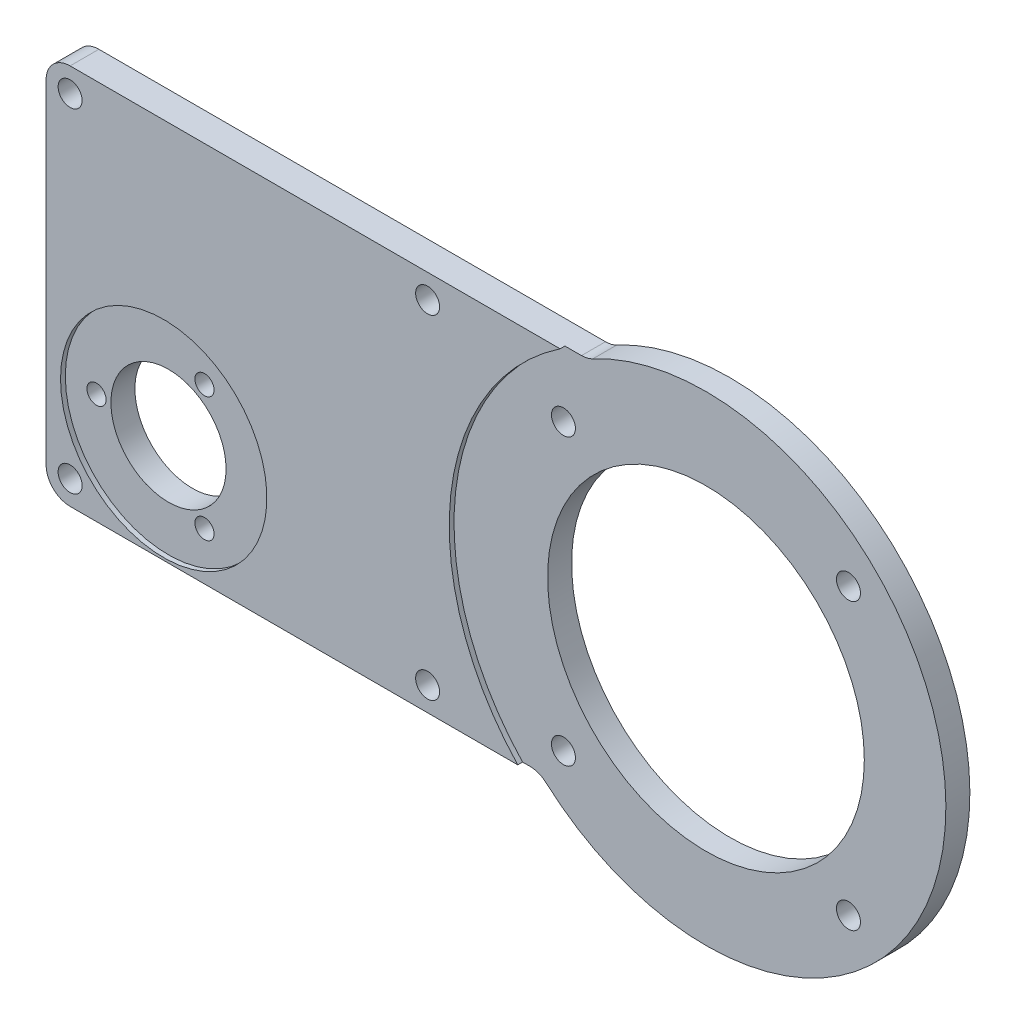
SolidWorks part; units mm, degrees
ref_plane "Plan de face" through (0, 0, 0) normal (0, 0, 1) x (1, 0, 0)
ref_plane "Plan de dessus" through (0, 0, 0) normal (0, 1, 0) x (1, 0, 0)
ref_plane "Plan de droite" through (0, 0, 0) normal (1, 0, 0) x (0, 0, -1)
ref_plane "Plan4" through (0, 0, 0) normal (0, 0, -1) x (-1, 0, 0)
sketch "Esquisse1" plane through (0, 0, 0) normal (0, 0, -1) x (-1, 0, 0)
  line L0 (73.3212, -72) -> (263, -72)
  line L1 (273, -62) -> (273, 77)
  line L2 (263, 87) -> (51.8748, 87)
  arc A0 (47.159, 88.1818) -> (66.6556, -74.5455) centre (0, 0) ccw
  arc A1 (66.6556, -74.5455) -> (73.3212, -72) centre (73.3212, -82) cw
  arc A2 (263, -72) -> (273, -62) centre (263, -62) ccw
  arc A3 (273, 77) -> (263, 87) centre (263, 77) ccw
  arc A4 (51.8748, 87) -> (47.159, 88.1818) centre (51.8748, 97) cw
extrude "Extrusion1" add sketch "Esquisse1" against normal blind 12
sketch "Esquisse2" plane through (0, 0, 12) normal (0, 0, 1) x (1, 0, 0)
  line L0 (-51.8748, 87) -> (-58.7878, 87)
  line L1 (-76.4264, -72) -> (-73.3212, -72)
  arc A0 (-47.159, 88.1818) -> (-51.8748, 87) centre (-51.8748, 97) cw
  arc A1 (-58.7878, 87) -> (-76.4264, -72) centre (0, 0) ccw
  arc A2 (-73.3212, -72) -> (-66.6556, -74.5455) centre (-73.3212, -82) cw
  arc A3 (-66.6556, -74.5455) -> (-47.159, 88.1818) centre (0, 0) ccw
extrude "Enlèv. mat.-Extru.1" cut sketch "Esquisse2" against normal blind 2
sketch "Esquisse3" plane through (0, 0, 12) normal (0, 0, 1) x (1, 0, 0)
  circle A0 centre (-224, -28) radius 43
extrude "Enlèv. mat.-Extru.2" cut sketch "Esquisse3" against normal blind 2
hole_wizard "Diamètre du perçage M10.0 (10)1" positions "Esquisse5" profile "Esquisse4" hole size "M10.0" standard "Ansi Métrique"
sketch "Esquisse5" plane through (0, 0, 10) normal (0, 0, 1) x (1, 0, 0)
  point P0 (59.397, -59.397)
sketch "Esquisse4" plane through (59.397, -59.397, 10) normal (1, 0, 0) x (0, -1, 0)
  line L0 (0, 0) -> (0, 10)
  line L1 (0, 10) -> (5, 10)
  line L2 (5, 10) -> (5, 0)
  line L5 (5, 0) -> (0, 0)
  line L11 (0, -6.35) -> (0, 107.95) construction
  dimension "Diamètre du perçage jusqu'au prochain" = 10
  dimension "Profondeur du perçage jusqu'au prochain" = 10
hole_wizard "Diamètre du perçage M10.0 (10)2" positions "Esquisse7" profile "Esquisse6" hole size "M10.0" standard "Ansi Métrique"
sketch "Esquisse7" plane through (0, 0, 10) normal (0, 0, 1) x (1, 0, 0)
  point P0 (59.397, 59.397)
sketch "Esquisse6" plane through (59.397, 59.397, 10) normal (1, 0, 0) x (0, -1, 0)
  line L0 (0, 0) -> (0, 10)
  line L1 (0, 10) -> (5, 10)
  line L2 (5, 10) -> (5, 0)
  line L5 (5, 0) -> (0, 0)
  line L11 (0, -6.35) -> (0, 107.95) construction
  dimension "Diamètre du perçage jusqu'au prochain" = 10
  dimension "Profondeur du perçage jusqu'au prochain" = 10
hole_wizard "Diamètre du perçage M10.0 (10)3" positions "Esquisse9" profile "Esquisse8" hole size "M10.0" standard "Ansi Métrique"
sketch "Esquisse9" plane through (0, 0, 12) normal (0, 0, 1) x (1, 0, 0)
  point P0 (-114, 77)
sketch "Esquisse8" plane through (-114, 77, 12) normal (1, 0, 0) x (0, -1, 0)
  line L0 (0, 0) -> (0, 12)
  line L1 (0, 12) -> (5, 12)
  line L2 (5, 12) -> (5, 0)
  line L5 (5, 0) -> (0, 0)
  line L11 (0, -6.35) -> (0, 107.95) construction
  dimension "Diamètre du perçage jusqu'au prochain" = 10
  dimension "Profondeur du perçage jusqu'au prochain" = 12
hole_wizard "Diamètre du perçage M10.0 (10)4" positions "Esquisse11" profile "Esquisse10" hole size "M10.0" standard "Ansi Métrique"
sketch "Esquisse11" plane through (0, 0, 10) normal (0, 0, 1) x (1, 0, 0)
  point P0 (-59.397, 59.397)
sketch "Esquisse10" plane through (-59.397, 59.397, 10) normal (1, 0, 0) x (0, -1, 0)
  line L0 (0, 0) -> (0, 10)
  line L1 (0, 10) -> (5, 10)
  line L2 (5, 10) -> (5, 0)
  line L5 (5, 0) -> (0, 0)
  line L11 (0, -6.35) -> (0, 107.95) construction
  dimension "Diamètre du perçage jusqu'au prochain" = 10
  dimension "Profondeur du perçage jusqu'au prochain" = 10
hole_wizard "Perçage1" positions "Esquisse13" profile "Esquisse12" legacy
sketch "Esquisse13" plane through (0, 0, 10) normal (0, 0, 1) x (1, 0, 0)
  point P0 (0, 0)
sketch "Esquisse12" plane through (0, 0, 10) normal (1, 0, 0) x (0, -1, 0)
  line L0 (0, 0) -> (0, 10)
  line L1 (0, 10) -> (66, 10)
  line L2 (66, 10) -> (66, 0)
  line L3 (66, 0) -> (0, 0)
  line L4 (0, 110) -> (0, -10) construction
  dimension "Diamètre" = 132
  dimension "Profondeur" = 10
hole_wizard "Diamètre du perçage M10.0 (10)5" positions "Esquisse15" profile "Esquisse14" hole size "M10.0" standard "Ansi Métrique"
sketch "Esquisse15" plane through (0, 0, 10) normal (0, 0, 1) x (1, 0, 0)
  point P0 (-59.397, -59.397)
sketch "Esquisse14" plane through (-59.397, -59.397, 10) normal (1, 0, 0) x (0, -1, 0)
  line L0 (0, 0) -> (0, 10)
  line L1 (0, 10) -> (5, 10)
  line L2 (5, 10) -> (5, 0)
  line L5 (5, 0) -> (0, 0)
  line L11 (0, -6.35) -> (0, 107.95) construction
  dimension "Diamètre du perçage jusqu'au prochain" = 10
  dimension "Profondeur du perçage jusqu'au prochain" = 10
hole_wizard "Diamètre du perçage M10.0 (10)6" positions "Esquisse17" profile "Esquisse16" hole size "M10.0" standard "Ansi Métrique"
sketch "Esquisse17" plane through (0, 0, 12) normal (0, 0, 1) x (1, 0, 0)
  point P0 (-114, -62)
sketch "Esquisse16" plane through (-114, -62, 12) normal (1, 0, 0) x (0, -1, 0)
  line L0 (0, 0) -> (0, 12)
  line L1 (0, 12) -> (5, 12)
  line L2 (5, 12) -> (5, 0)
  line L5 (5, 0) -> (0, 0)
  line L11 (0, -6.35) -> (0, 107.95) construction
  dimension "Diamètre du perçage jusqu'au prochain" = 10
  dimension "Profondeur du perçage jusqu'au prochain" = 12
hole_wizard "Diamètre du perçage M8.0 (8)1" positions "Esquisse19" profile "Esquisse18" hole size "M8.0" standard "Ansi Métrique"
sketch "Esquisse19" plane through (0, 0, 10) normal (0, 0, 1) x (1, 0, 0)
  point P0 (-209, -2.0192)
sketch "Esquisse18" plane through (-209, -2.0192, 10) normal (1, 0, 0) x (0, -1, 0)
  line L0 (0, 0) -> (0, 10)
  line L1 (0, 10) -> (4, 10)
  line L2 (4, 10) -> (4, 0)
  line L5 (4, 0) -> (0, 0)
  line L11 (0, -6.35) -> (0, 107.95) construction
  dimension "Diamètre du perçage jusqu'au prochain" = 8
  dimension "Profondeur du perçage jusqu'au prochain" = 10
hole_wizard "Diamètre du perçage M8.0 (8)2" positions "Esquisse21" profile "Esquisse20" hole size "M8.0" standard "Ansi Métrique"
sketch "Esquisse21" plane through (0, 0, 10) normal (0, 0, 1) x (1, 0, 0)
  point P0 (-254, -28)
sketch "Esquisse20" plane through (-254, -28, 10) normal (1, 0, 0) x (0, -1, 0)
  line L0 (0, 0) -> (0, 10)
  line L1 (0, 10) -> (4, 10)
  line L2 (4, 10) -> (4, 0)
  line L5 (4, 0) -> (0, 0)
  line L11 (0, -6.35) -> (0, 107.95) construction
  dimension "Diamètre du perçage jusqu'au prochain" = 8
  dimension "Profondeur du perçage jusqu'au prochain" = 10
hole_wizard "Diamètre du perçage M8.0 (8)3" positions "Esquisse23" profile "Esquisse22" hole size "M8.0" standard "Ansi Métrique"
sketch "Esquisse23" plane through (0, 0, 10) normal (0, 0, 1) x (1, 0, 0)
  point P0 (-209, -53.9808)
sketch "Esquisse22" plane through (-209, -53.9808, 10) normal (1, 0, 0) x (0, -1, 0)
  line L0 (0, 0) -> (0, 10)
  line L1 (0, 10) -> (4, 10)
  line L2 (4, 10) -> (4, 0)
  line L5 (4, 0) -> (0, 0)
  line L11 (0, -6.35) -> (0, 107.95) construction
  dimension "Diamètre du perçage jusqu'au prochain" = 8
  dimension "Profondeur du perçage jusqu'au prochain" = 10
hole_wizard "Dégagement M421" positions "Esquisse25" profile "Esquisse24" hole size "M42" standard "Ansi Métrique"
sketch "Esquisse25" plane through (0, 0, 10) normal (0, 0, 1) x (1, 0, 0)
  point P0 (-224, -28)
sketch "Esquisse24" plane through (-224, -28, 10) normal (1, 0, 0) x (0, -1, 0)
  line L0 (0, 0) -> (0, 10)
  line L1 (0, 10) -> (24, 10)
  line L2 (24, 10) -> (24, 0)
  line L5 (24, 0) -> (0, 0)
  line L11 (0, -6.35) -> (0, 107.95) construction
  dimension "Diamètre du perçage jusqu'au prochain" = 48
  dimension "Profondeur du perçage jusqu'au prochain" = 10
hole_wizard "Diamètre du perçage M10.0 (10)7" positions "Esquisse27" profile "Esquisse26" hole size "M10.0" standard "Ansi Métrique"
sketch "Esquisse27" plane through (0, 0, 12) normal (0, 0, 1) x (1, 0, 0)
  point P0 (-263, -62)
sketch "Esquisse26" plane through (-263, -62, 12) normal (1, 0, 0) x (0, -1, 0)
  line L0 (0, 0) -> (0, 12)
  line L1 (0, 12) -> (5, 12)
  line L2 (5, 12) -> (5, 0)
  line L5 (5, 0) -> (0, 0)
  line L11 (0, -6.35) -> (0, 107.95) construction
  dimension "Diamètre du perçage jusqu'au prochain" = 10
  dimension "Profondeur du perçage jusqu'au prochain" = 12
hole_wizard "Diamètre du perçage M10.0 (10)8" positions "Esquisse29" profile "Esquisse28" hole size "M10.0" standard "Ansi Métrique"
sketch "Esquisse29" plane through (0, 0, 12) normal (0, 0, 1) x (1, 0, 0)
  point P0 (-263, 77)
sketch "Esquisse28" plane through (-263, 77, 12) normal (1, 0, 0) x (0, -1, 0)
  line L0 (0, 0) -> (0, 12)
  line L1 (0, 12) -> (5, 12)
  line L2 (5, 12) -> (5, 0)
  line L5 (5, 0) -> (0, 0)
  line L11 (0, -6.35) -> (0, 107.95) construction
  dimension "Diamètre du perçage jusqu'au prochain" = 10
  dimension "Profondeur du perçage jusqu'au prochain" = 12
